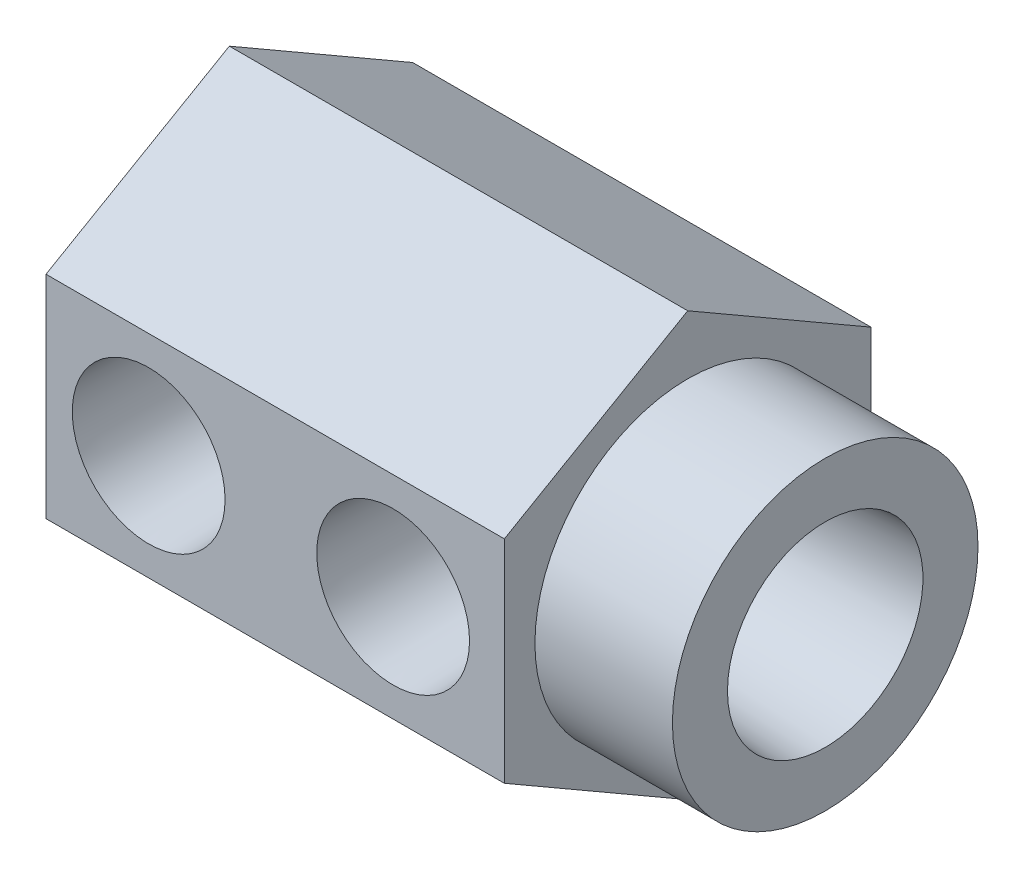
SolidWorks part; units mm, degrees
ref_plane "Front Plane" through (0, 0, 0) normal (0, 0, 1) x (1, 0, 0)
ref_plane "Top Plane" through (0, 0, 0) normal (0, 1, 0) x (1, 0, 0)
ref_plane "Right Plane" through (0, 0, 0) normal (1, 0, 0) x (0, 0, -1)
sketch "Sketch1" plane through (0, 0, 0) normal (1, 0, 0) x (0, 0, -1)
  line L0 (0, 12.0984) -> (0, -12.0984) construction
  line L1 (9.525, -5.4993) -> (9.525, 5.4993)
  line L2 (9.525, 5.4993) -> (0, 10.9985)
  line L3 (0, 10.9985) -> (-9.525, 5.4993)
  line L4 (-9.525, 5.4993) -> (-9.525, -5.4993)
  line L5 (-9.525, -5.4993) -> (0, -10.9985)
  line L6 (0, -10.9985) -> (9.525, -5.4993)
  circle A0 centre (0, 0) radius 9.525 construction
  dimension "D1" = 19.05
extrude "Boss-Extrude1" add sketch "Sketch1" along normal blind 23.8125 separate body
sketch "Sketch2" plane through (23.8125, 0, 0) normal (1, 0, 0) x (0, 0, -1)
  circle A1 centre (0, 0) radius 7.9375
  dimension "D1" = 15.875
extrude "Boss-Extrude2" add sketch "Sketch2" along normal blind 7.1437
sketch "Sketch3" plane through (0, 0, 0) normal (0, 1, 0) x (1, 0, 0)
  line L0 (30.9563, -7.9375) -> (30.9563, 7.9375) construction
  line L1 (30.9563, 0) -> (30.9563, 5.0775)
  line L2 (-5.6164, 0) -> (49994.3836, 0) construction
  line L8 (14.3193, 0) -> (14.3193, 3.4163)
  line L9 (23.9712, 3.4163) -> (14.3193, 3.4163)
  line L10 (23.9712, 3.4163) -> (23.9712, 4.7114)
  line L11 (30.9563, 5.0775) -> (23.9712, 4.7114)
  line L12 (14.3193, 0) -> (30.9563, 0)
  dimension "D1" = 6.8326
  dimension "D2" = 16.637
  dimension "D3" = 6.985
  dimension "D4" = 3
  dimension "D5" = 10.1549
revolve "Cut-Revolve1" cut sketch "Sketch3" angle 360 about L2
hole_wizard "1/16 NPT Tapped Hole1" positions "Sketch5" profile "Sketch4" size "1/16" standard "Ansi Inch"
sketch "Sketch5" plane through (0, 0, -9.525) normal (0, 0, -1) x (-1, 0, 0)
  line L0 (10.4775, 0) -> (-10.4775, 0) construction
  line L1 (0, 10.4775) -> (0, -10.4775) construction
  point P0 (-5.334, 0)
  dimension "D1" = 5.334
sketch "Sketch4" plane through (5.334, 0, -9.525) normal (1, 0, 0) x (0, 1, 0)
  line L0 (0, 0) -> (0, 13.4367)
  line L1 (3.0734, 11.59) -> (0, 13.4367)
  line L2 (-3.0734, 11.59) -> (0, 13.4367) construction
  line L3 (3.0734, 11.59) -> (3.0734, 6.8859)
  line L4 (3.0734, 6.8859) -> (3.7626, 6.8859)
  line L5 (3.7626, 6.8859) -> (3.9688, 0)
  line L6 (-3.7626, 6.8859) -> (-3.9688, 0) construction
  line L7 (3.9688, 0) -> (0, 0)
  line L8 (0, -6.35) -> (0, 107.95) construction
  line L11 (-3.0734, 6.8859) -> (-3.7626, 6.8859) construction
  dimension "Tap Drill Dia." = 6.1468
  dimension "Tap Drill Depth" = 11.59
  dimension "Thread Dia." = 7.9375
  dimension "Thread Angle" = 3.43
  dimension "Thread Depth" = 6.8859
  dimension "Drill Angle" = 118
hole_wizard "1/16 NPT Tapped Hole2" positions "Sketch7" profile "Sketch6" size "1/16" standard "Ansi Inch"
sketch "Sketch7" plane through (0, 0, 9.525) normal (0, 0, 1) x (1, 0, 0)
  circle A0 centre (5.334, 0) radius 3.9688 construction
  point P0 (5.334, 0)
  point P1 (18.034, 0)
  dimension "D1" = 12.7
sketch "Sketch6" plane through (5.334, 0, 9.525) normal (1, 0, 0) x (0, -1, 0)
  line L0 (0, 0) -> (0, 17.7217)
  line L1 (3.0734, 15.875) -> (0, 17.7217)
  line L2 (-3.0734, 15.875) -> (0, 17.7217) construction
  line L3 (3.0734, 15.875) -> (3.0734, 6.8859)
  line L4 (3.0734, 6.8859) -> (3.7626, 6.8859)
  line L5 (3.7626, 6.8859) -> (3.9688, 0)
  line L6 (-3.7626, 6.8859) -> (-3.9688, 0) construction
  line L7 (3.9688, 0) -> (0, 0)
  line L8 (0, -6.35) -> (0, 107.95) construction
  line L11 (-3.0734, 6.8859) -> (-3.7626, 6.8859) construction
  dimension "Tap Drill Dia." = 6.1468
  dimension "Tap Drill Depth" = 15.875
  dimension "Thread Dia." = 7.9375
  dimension "Thread Angle" = 3.43
  dimension "Thread Depth" = 6.8859
  dimension "Drill Angle" = 118
hole_wizard "1/4-28 Tapped Hole1" positions "Sketch9" profile "Sketch8" tap size "1/4-28" standard "ANSI Inch"
sketch "Sketch9" plane through (30.9563, 0, 0) normal (1, 0, 0) x (0, 0, -1)
  circle A0 centre (0, 0) radius 5.0775 construction
  point P0 (0, 0)
sketch "Sketch8" plane through (30.9563, 0, 0) normal (0, 1, 0) x (0, 0, -1)
  line L0 (0, 0) -> (0, 26.5707)
  line L1 (0, 26.5707) -> (2.7051, 24.9453)
  line L2 (2.7051, 24.9453) -> (2.7051, 22.86)
  line L3 (2.7051, 22.86) -> (3.175, 22.86)
  line L4 (3.175, 22.86) -> (3.175, 0)
  line L5 (3.175, 0) -> (0, 0)
  line L10 (0, 26.5707) -> (-2.7051, 24.9453) construction
  line L11 (0, -6.35) -> (0, 107.95) construction
  dimension "Tap Drill Dia." = 5.4102
  dimension "Tap Drill Depth" = 24.9453
  dimension "Thread Major Dia." = 6.35
  dimension "Thread Depth" = 22.86
  dimension "Drill Angle" = 118
